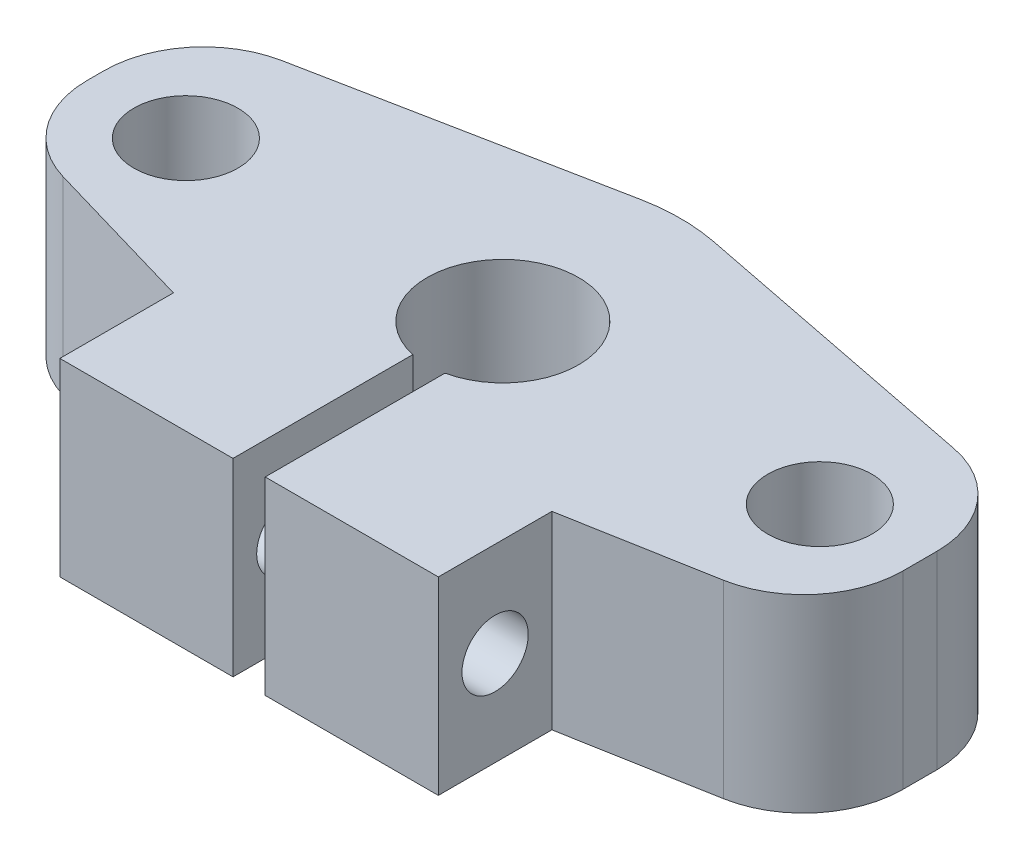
SolidWorks part; units mm, degrees
ref_plane "Ebene vorne" through (0, 0, 0) normal (0, 0, 1) x (1, 0, 0)
ref_plane "Ebene oben" through (0, 0, 0) normal (0, 1, 0) x (1, 0, 0)
ref_plane "Ebene rechts" through (0, 0, 0) normal (1, 0, 0) x (0, 0, -1)
sketch "Skizze1" plane through (0, 0, 0) normal (0, 1, 0) x (1, 0, 0)
  line L0 (10, 0) -> (0.85, 0)
  line L1 (-10, 0) -> (-0.85, 0)
  line L2 (-10, 0) -> (-10, 6)
  line L3 (10, 0) -> (10, 6)
  line L4 (0.85, 0) -> (0.85, 9.5)
  line L5 (-0.85, 0) -> (-0.85, 9.5)
  line L6 (22, 16.1595) -> (22, 10.6595)
  line L7 (22, 10.6595) -> (22, 8.1595)
  line L8 (0, 23) -> (-22, 18.6595)
  line L9 (-10, 6) -> (-22, 9.5)
  line L10 (-22, 9.5) -> (-22, 18.6595)
  line L11 (22, 16.1595) -> (22, 18.6595)
  line L12 (10, 6) -> (22, 8.1595)
  line L13 (22, 18.6595) -> (0, 23)
  arc A0 (0.85, 9.5) -> (-0.85, 9.5) centre (0, 13.4095) ccw
  circle A1 centre (16.75, 13.4095) radius 2.75
  circle A2 centre (-16.75, 13.4095) radius 2.75
  dimension "D1" = 9.15
  dimension "D2" = 9.15
  dimension "D3" = 6
  dimension "D4" = 9.5
  dimension "D5" = 2.5
  dimension "D8" = 2.5
extrude "Aufsatz-Linear austragen1" add sketch "Skizze1" along normal blind 10
fillet "Verrundung1" radius 5.25 1 edges at (-22, 5, -18.6595)
fillet "Verrundung2" radius 5.25 1 edges at (-22, 5, -9.5)
fillet "Verrundung3" radius 5.25 1 edges at (22, 5, -8.1595)
fillet "Verrundung4" radius 5.25 1 edges at (22, 5, -18.6595)
fillet "Verrundung5" radius 10 1 edges at (0, 5, -23)
sketch "Skizze2" plane through (-10, 0, 0) normal (-1, 0, 0) x (0, 0, 1)
  circle A0 centre (-3, 5) radius 1.75
extrude "Schnitt-Linear austragen1" cut sketch "Skizze2" against normal blind 20
